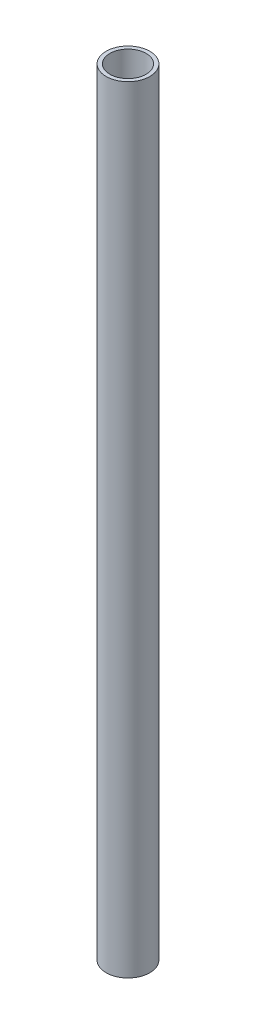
SolidWorks part; units mm, degrees
ref_plane "Front Plane" through (0, 0, 0) normal (0, 0, 1) x (1, 0, 0)
ref_plane "Top Plane" through (0, 0, 0) normal (0, 1, 0) x (1, 0, 0)
ref_plane "Right Plane" through (0, 0, 0) normal (1, 0, 0) x (0, 0, -1)
sketch "Sketch1" plane through (0, 0, 0) normal (0, 1, 0) x (1, 0, 0)
  circle A0 centre (0, 0) radius 8.89
  circle A1 centre (0, 0) radius 10.7315
  dimension "D1" = 21.463
  dimension "D2" = 17.78
extrude "Extrude1" add sketch "Sketch1" against normal blind 381
